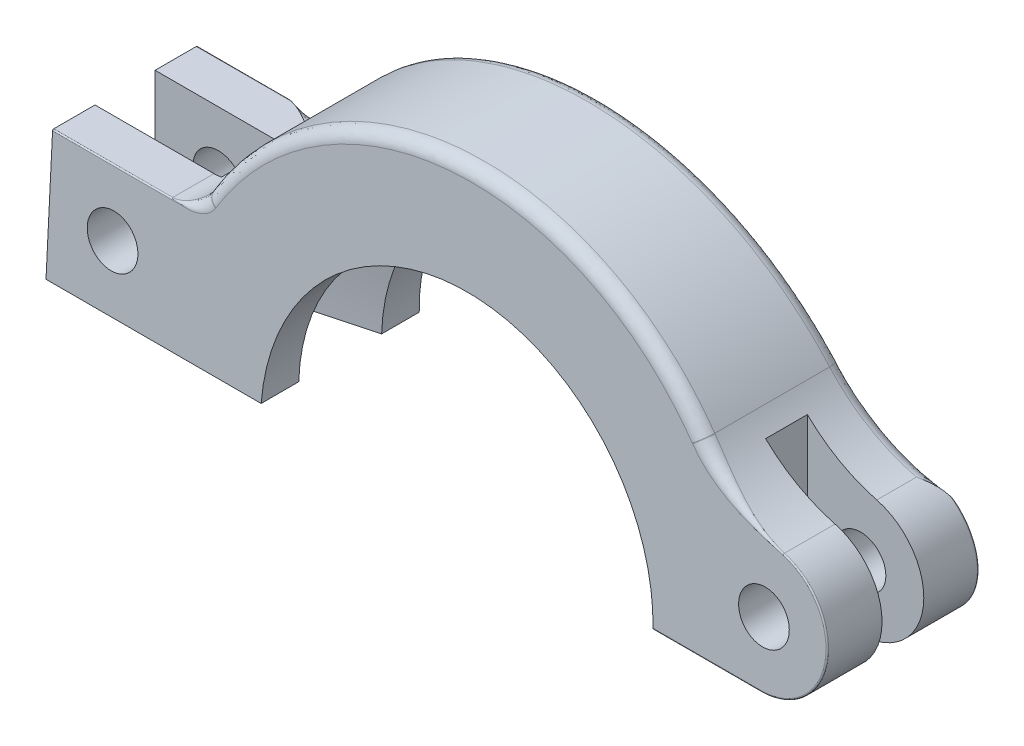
SolidWorks part; units mm, degrees
ref_plane "Plan de face" through (0, 0, 0) normal (0, 0, 1) x (1, 0, 0)
ref_plane "Plan de dessus" through (0, 0, 0) normal (0, 1, 0) x (1, 0, 0)
ref_plane "Plan de droite" through (0, 0, 0) normal (1, 0, 0) x (0, 0, -1)
imported_body "Importée3"
sketch "Esquisse1" plane through (-46.1871, 0, 0) normal (-1, 0, 0) x (0, 0, 1)
  line L0 (1.0482, 21) -> (23.9518, 21)
  line L1 (23.9518, 21) -> (23.9518, 1)
  line L2 (7.75, 1) -> (0, 1)
  line L3 (0, 1) -> (1.0482, 21)
  spline S0 degree 3 poles (23.9518, 1) (23.8886, 1) (23.8253, 1) (23.7621, 1) knots 0 0 0 0 1 1 1 1
  spline S1 degree 3 poles (23.7621, 1) (21.5914, 1) (19.4207, 1) (17.25, 1) knots 0 0 0 0 1 1 1 1
  spline S2 degree 3 poles (17.25, 1) (14.0833, 1) (10.9167, 1) (7.75, 1) knots 0 0 0 0 1 1 1 1
extrude "Boss.-Extru.1" add sketch "Esquisse1" along normal blind 18.8129
sketch "Esquisse2" plane through (0, 0, 23.9518) normal (0, 0, 1) x (1, 0, 0)
  line L0 (-46.1871, 1) -> (-46.1871, 21)
  line L1 (-46.1871, 21) -> (-65, 21)
  line L2 (-65, 21) -> (-65, 1)
  line L3 (-65, 1) -> (-46.1871, 1)
extrude "Enlèv. mat.-Extru.1" cut sketch "Esquisse2" against normal blind 0.1898
sketch "Esquisse3" plane through (0, 0, 23.7621) normal (0, 0, 1) x (1, 0, 0)
  line L0 (-46.1871, 1) -> (-46.1871, 21)
  line L1 (-46.1871, 21) -> (-65, 21)
  line L2 (-65, 21) -> (-65, 1)
  line L3 (-65, 1) -> (-46.1871, 1)
extrude "Enlèv. mat.-Extru.2" cut sketch "Esquisse3" against normal blind 6.5121
sketch "Esquisse4" plane through (0, 0, 17.25) normal (0, 0, 1) x (1, 0, 0)
  line L0 (-45, 1) -> (-45, 21.1186)
  line L1 (-46.1871, 21) -> (-65, 21)
  line L2 (-65, 21) -> (-65, 1)
  line L3 (-65, 1) -> (-45, 1)
  arc A0 (-45, 21.1186) -> (-46.1871, 21) centre (-46.1871, 27) cw
extrude "Enlèv. mat.-Extru.3" cut sketch "Esquisse4" against normal blind 9.5
sketch "Esquisse5" plane through (-46.1871, 0, 0) normal (-1, 0, 0) x (0, 0, 1)
  line L0 (23.9518, 21) -> (25, 1)
  line L1 (25, 1) -> (17.25, 1)
  line L2 (17.25, 1) -> (17.25, 21)
  line L3 (17.25, 21) -> (23.9518, 21)
extrude "Boss.-Extru.2" add sketch "Esquisse5" along normal blind 18.8129
sketch "Esquisse6" plane through (0, 1, 0) normal (0, -1, 0) x (1, 0, 0)
  line L0 (66.3836, 9.2) -> (66.3836, 15.8)
  line L1 (66.3836, 15.8) -> (39.5874, 15.8)
  line L2 (39.5874, 15.8) -> (39.5874, 9.2)
  line L3 (39.5874, 9.2) -> (66.3836, 9.2)
extrude "Enlèv. mat.-Extru.4" cut sketch "Esquisse6" against normal up to next
hole_wizard "Diamètre du perçage Ø8.0 (8)1" positions "Esquisse8" profile "Esquisse7" hole size "Ø8.0" standard "Ansi Metric"
sketch "Esquisse8" plane through (0, 0, 17.25) normal (0, 0, -1) x (-1, 0, 0)
  point P0 (55, 11)
sketch "Esquisse7" plane through (-55, 11, 17.25) normal (1, 0, 0) x (0, 1, 0)
  line L0 (0, 0) -> (0, 7.75)
  line L1 (0, 7.75) -> (4, 7.75)
  line L2 (4, 7.75) -> (4, 0)
  line L5 (4, 0) -> (0, 0)
  line L11 (0, -6.35) -> (0, 107.95) construction
  dimension "Diamètre du perçage jusqu'au prochain" = 8
  dimension "Profondeur du perçage jusqu'au prochain" = 7.75
hole_wizard "Diamètre du perçage Ø8.0 (8)2" positions "Esquisse10" profile "Esquisse9" hole size "Ø8.0" standard "Ansi Metric"
sketch "Esquisse10" plane through (0, 0, 15.8) normal (0, 0, -1) x (-1, 0, 0)
  point P0 (-48, 11)
sketch "Esquisse9" plane through (48, 11, 15.8) normal (1, 0, 0) x (0, 1, 0)
  line L0 (0, 0) -> (0, 9.2)
  line L1 (0, 9.2) -> (4, 9.2)
  line L2 (4, 9.2) -> (4, 0)
  line L5 (4, 0) -> (0, 0)
  line L11 (0, -6.35) -> (0, 107.95) construction
  dimension "Diamètre du perçage jusqu'au prochain" = 8
  dimension "Profondeur du perçage jusqu'au prochain" = 9.2
hole_wizard "Diamètre du perçage Ø8.0 (8)3" positions "Esquisse12" profile "Esquisse11" hole size "Ø8.0" standard "Ansi Metric"
sketch "Esquisse12" plane through (0, 0, 7.75) normal (0, 0, 1) x (1, 0, 0)
  point P0 (-55, 11)
sketch "Esquisse11" plane through (-55, 11, 7.75) normal (1, 0, 0) x (0, -1, 0)
  line L0 (0, 0) -> (0, 7.75)
  line L1 (0, 7.75) -> (4, 7.75)
  line L2 (4, 7.75) -> (4, 0)
  line L5 (4, 0) -> (0, 0)
  line L11 (0, -6.35) -> (0, 107.95) construction
  dimension "Diamètre du perçage jusqu'au prochain" = 8
  dimension "Profondeur du perçage jusqu'au prochain" = 7.75
hole_wizard "Diamètre du perçage Ø8.0 (8)4" positions "Esquisse14" profile "Esquisse13" hole size "Ø8.0" standard "Ansi Metric"
sketch "Esquisse14" plane through (0, 0, 9.2) normal (0, 0, 1) x (1, 0, 0)
  point P0 (48, 11)
sketch "Esquisse13" plane through (48, 11, 9.2) normal (1, 0, 0) x (0, -1, 0)
  line L0 (0, 0) -> (0, 9.2)
  line L1 (0, 9.2) -> (4, 9.2)
  line L2 (4, 9.2) -> (4, 0)
  line L5 (4, 0) -> (0, 0)
  line L11 (0, -6.35) -> (0, 107.95) construction
  dimension "Diamètre du perçage jusqu'au prochain" = 8
  dimension "Profondeur du perçage jusqu'au prochain" = 9.2
fillet "Congé1" radius 2 3 edges at (-43.2012, 21.7958, 1.0899) (-3.2656, 47.3876, 2.4311)
fillet "Congé2" radius 0.2 14 edges at (39.4919, 1, 25) (39.4919, 1, 0) (0, 31, 23.4278) (0, 31, 1.5722) (-58.1788, 21, 1.0482) (-44.8373, 19.2194, 0.9548) (53.9248, 19.0558, 1.1904) (-44.0824, 21, 23.9017) (50.9609, 20.5516, 23.8474)
ref_plane "Plan_median" through (0, 0, 12.29) normal (0, 0, 1) x (1, 0, 0)
